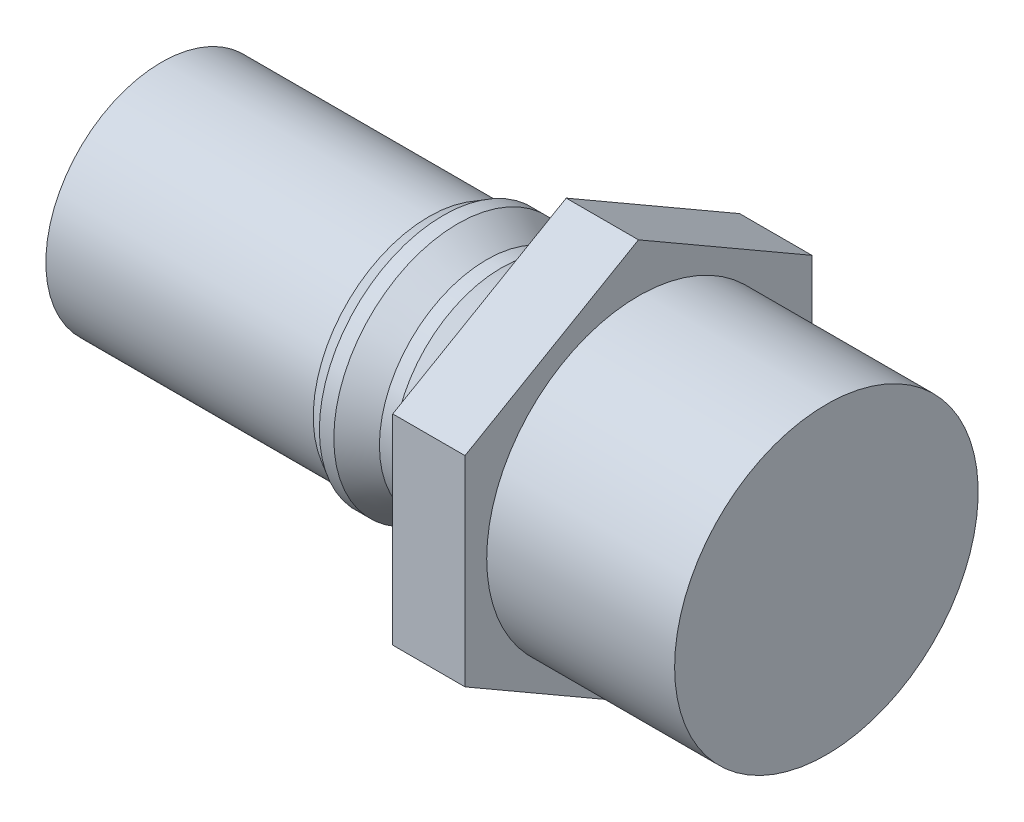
SolidWorks part; units mm, degrees
ref_plane "Alzado" through (0, 0, 0) normal (0, 0, 1) x (1, 0, 0)
ref_plane "Planta" through (0, 0, 0) normal (0, 1, 0) x (1, 0, 0)
ref_plane "Vista lateral" through (0, 0, 0) normal (1, 0, 0) x (0, 0, -1)
sketch "Croquis1" plane through (0, 0, 0) normal (0, 0, 1) x (1, 0, 0)
  line L0 (0, 0) -> (28, 0) construction
  line L1 (0, 0) -> (0, 8)
  line L2 (0, 8) -> (18.5, 8)
  line L3 (18.5, 8) -> (19.5, 8.5774)
  line L4 (19.5, 8.5774) -> (20.5, 8.5774)
  line L5 (20, 8.5774) -> (20, 0) construction
  line L6 (21.5, 8) -> (20.5, 8.5774)
  line L7 (21.5, 8) -> (22.5, 7.4226)
  line L8 (22.5, 7.4226) -> (23.5, 7.4226)
  line L9 (23, 7.4226) -> (23, 0) construction
  line L10 (24.5, 8) -> (23.5, 7.4226)
  line L11 (24.5, 8) -> (25.5, 8.5774)
  line L12 (25.5, 8.5774) -> (28, 8.5774)
  line L13 (28, 8.5774) -> (28, 0)
  line L14 (28, 0) -> (0, 0)
  dimension "D1" = 16
  dimension "D2" = 18.5
  dimension "D3" = 1
  dimension "D4" = 1
  dimension "D5" = 150
  dimension "D6" = 1
  dimension "D7" = 1
  dimension "D8" = 2.5
revolve "Revolución1" add sketch "Croquis1" angle 360 about L14
sketch "Croquis4" plane through (28, 0, 0) normal (1, 0, 0) x (0, 0, -1)
  line L1 (0, 13.8564) -> (-12, 6.9282)
  line L2 (-12, 6.9282) -> (-12, -6.9282)
  line L3 (-12, -6.9282) -> (0, -13.8564)
  line L4 (0, -13.8564) -> (12, -6.9282)
  line L5 (12, -6.9282) -> (12, 6.9282)
  line L6 (12, 6.9282) -> (0, 13.8564)
  circle A0 centre (0, 0) radius 12 construction
  dimension "D1" = 24
extrude "Saliente-Extruir3" add sketch "Croquis4" along normal blind 5
sketch "Croquis5" plane through (33, 0, 0) normal (1, 0, 0) x (0, 0, -1)
  circle A0 centre (0, 0) radius 10.5
  dimension "D1" = 21
extrude "Saliente-Extruir4" add sketch "Croquis5" along normal blind 13
